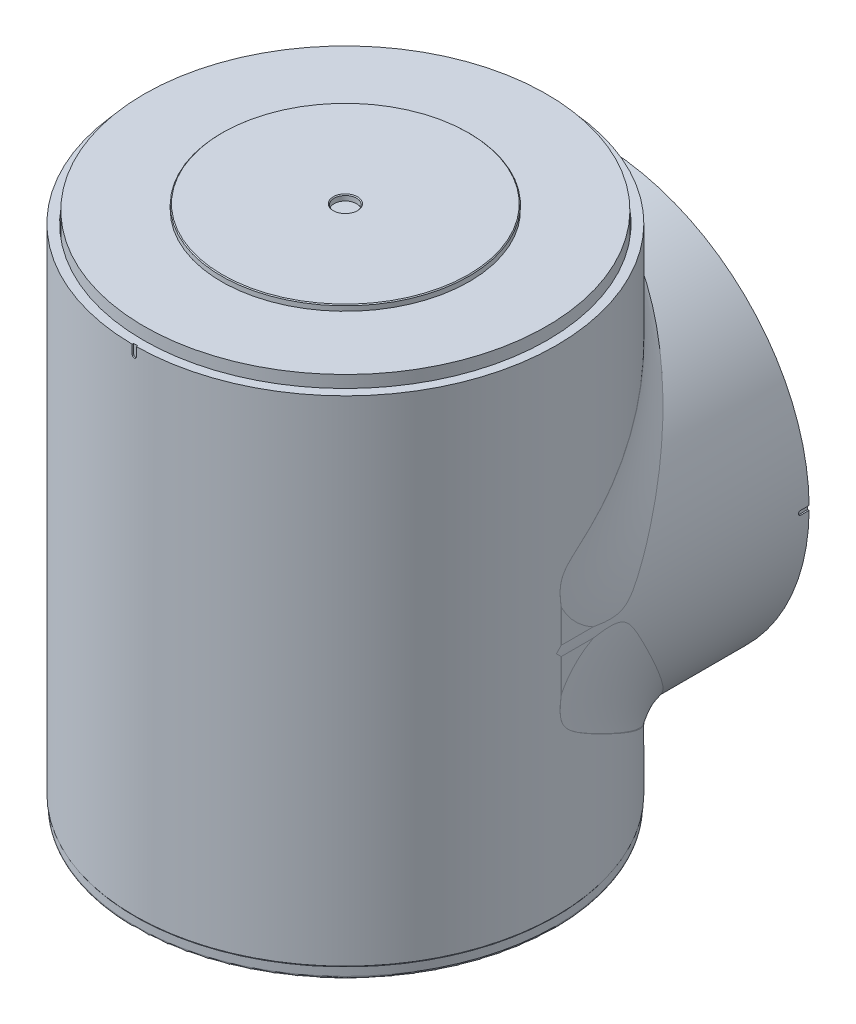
SolidWorks part; units mm, degrees
other "<4.0.07.2008582>-<输入1>"
other "<4.0.07.2008582>-<输入1>"
other "<4.0.07.2008583>-<凸台-拉伸1>"
other "<4.0.07.2008582>-<输入1>"
ref_plane "前视基准面" through (0, 0, 0) normal (0, 0, 1) x (1, 0, 0)
ref_plane "上视基准面" through (0, 0, 0) normal (0, 1, 0) x (1, 0, 0)
ref_plane "右视基准面" through (0, 0, 0) normal (1, 0, 0) x (0, 0, -1)
imported_body "FR10-V6.0-2-1-solid1"
imported_body "32-1-solid1"
other "移动面1" parameters "D1"=6.44
other "移动面2" parameters "D1"=6.44
inserted part "4.0.07.2008582"
move or copy body "实体-移动/复制2" placed by mates yes
inserted part "4.0.07.2008583"
move or copy body "实体-移动/复制4" placed by mates yes
inserted part "4.0.07.20085822"
move or copy body "实体-移动/复制6" placed by mates yes
inserted part "4.0.07.20085823"
move or copy body "实体-移动/复制8" placed by mates yes
sketch "草图5" plane through (0, 0, 32.6155) normal (0, 0, -1) x (-1, 0, 0)
  circle A0 centre (-77.2873, 116.7293) radius 71.5
extrude "凸台-拉伸1" add sketch "草图5" against normal blind 80
